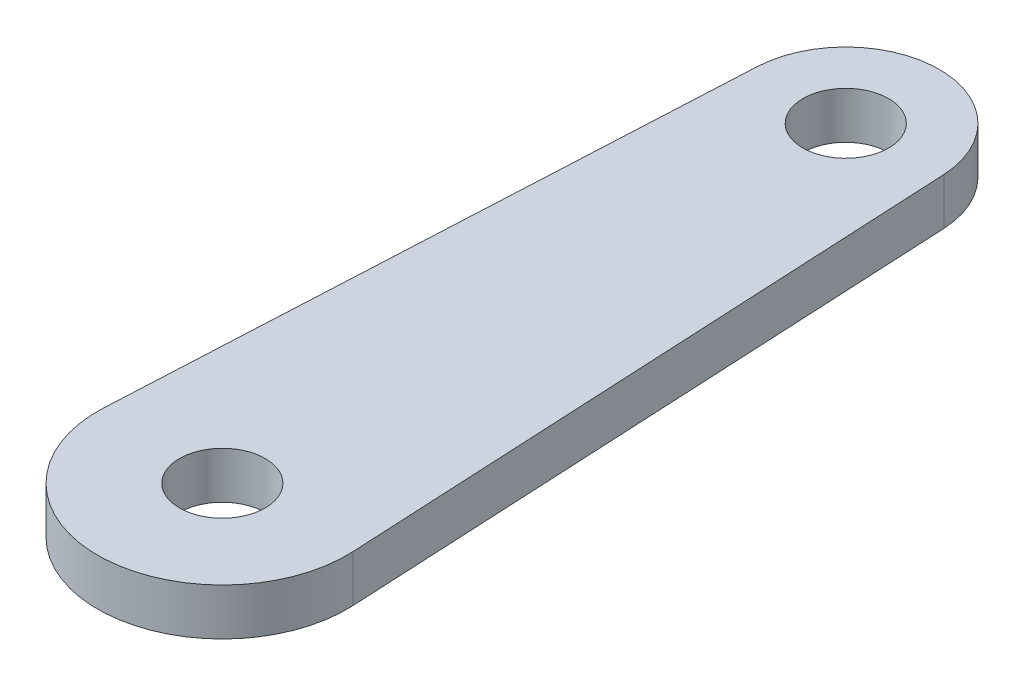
SolidWorks part; units mm, degrees
ref_plane "Front Plane" through (0, 0, 0) normal (0, 0, 1) x (1, 0, 0)
ref_plane "Top Plane" through (0, 0, 0) normal (0, 1, 0) x (1, 0, 0)
ref_plane "Right Plane" through (0, 0, 0) normal (1, 0, 0) x (0, 0, -1)
sketch "Sketch1" plane through (0, 0, 0) normal (0, 1, 0) x (1, 0, 0)
  line L0 (0, 0) -> (0, 40) construction
  line L1 (-5.9925, 40.3) -> (-7.99, 0.4)
  line L2 (5.9925, 40.3) -> (7.99, 0.4)
  circle A0 centre (0, 0) radius 2.75
  circle A1 centre (0, 40) radius 2.75
  arc A2 (5.9925, 40.3) -> (-5.9925, 40.3) centre (0, 40) ccw
  arc A3 (-7.99, 0.4) -> (7.99, 0.4) centre (0, 0) ccw
  dimension "D2" = 5.5
  dimension "D3" = 5.5
  dimension "D4" = 16
  dimension "D5" = 12
  dimension "D1" = 40
extrude "Extrude1" add sketch "Sketch1" along normal blind 3
